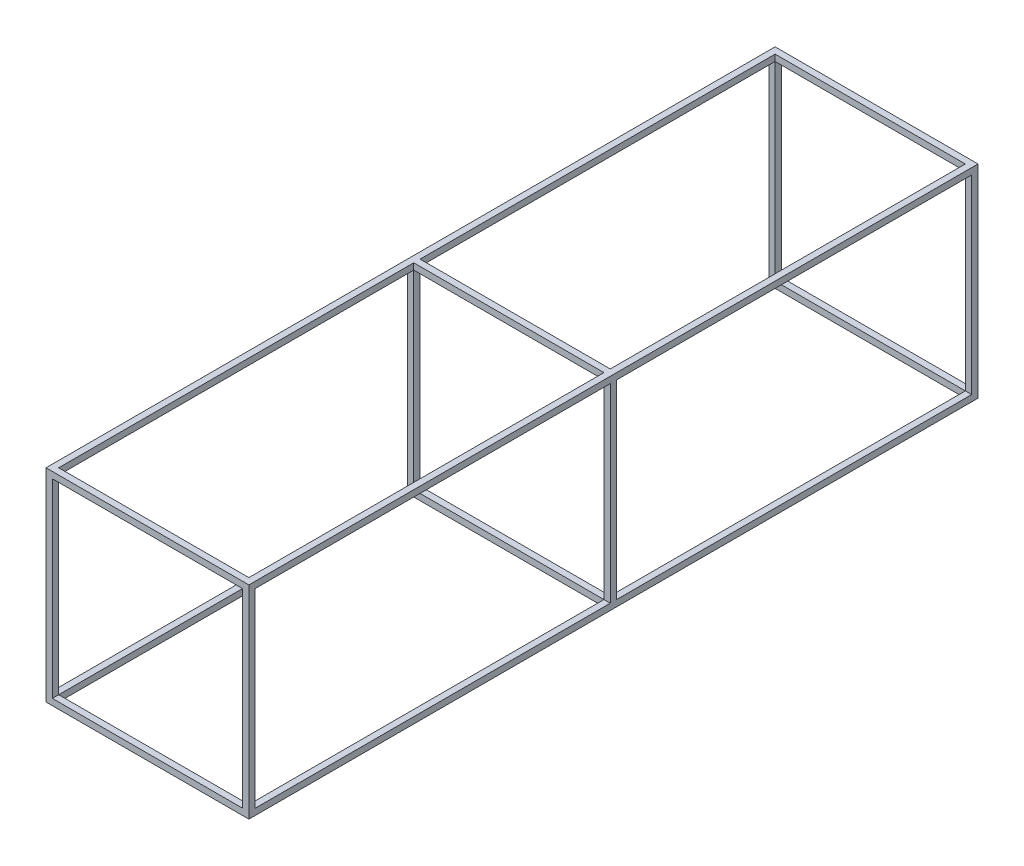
SolidWorks part; units mm, degrees
ref_plane "Front Plane" through (0, 0, 0) normal (0, 0, 1) x (1, 0, 0)
ref_plane "Top Plane" through (0, 0, 0) normal (0, 1, 0) x (1, 0, 0)
ref_plane "Right Plane" through (0, 0, 0) normal (1, 0, 0) x (0, 0, -1)
sketch "Sketch1" plane through (0, 0, 0) normal (0, 0, 1) x (1, 0, 0)
  line L0 (0, 0) -> (0, 160)
  line L1 (0, 160) -> (160, 160)
  line L2 (160, 160) -> (160, 0)
  line L3 (160, 0) -> (0, 0)
  line L4 (5, 155) -> (5, 5)
  line L5 (5, 5) -> (155, 5)
  line L6 (155, 5) -> (155, 155)
  line L7 (155, 155) -> (5, 155)
  dimension "D1" = 160
  dimension "D2" = 160
  dimension "D3" = 5
  dimension "D4" = 5
  dimension "D5" = 5
  dimension "D6" = 5
extrude "Boss-Extrude1" add sketch "Sketch1" along normal blind 5
sketch "Sketch2" plane through (0, 0, 5) normal (0, 0, 1) x (1, 0, 0)
  line L0 (5, 155) -> (5, 160)
  line L1 (160, 160) -> (0, 160) construction
  line L2 (5, 160) -> (0, 160)
  line L3 (0, 160) -> (0, 155)
  line L4 (0, 160) -> (0, 0) construction
  line L5 (0, 155) -> (5, 155)
  line L6 (5, 5) -> (5, 0)
  line L7 (5, 5) -> (155, 5) construction
  line L8 (5, 155) -> (5, 5) construction
  line L9 (0, 0) -> (160, 0) construction
  line L10 (5, 0) -> (0, 0)
  line L11 (0, 0) -> (0, 5)
  line L12 (0, 5) -> (5, 5)
  line L13 (155, 5) -> (160, 5)
  line L14 (160, 0) -> (160, 160) construction
  line L15 (160, 5) -> (160, 0)
  line L16 (160, 0) -> (155, 0)
  line L17 (155, 0) -> (155, 5)
  line L18 (155, 155) -> (160, 155)
  line L19 (160, 155) -> (160, 160)
  line L20 (160, 160) -> (155, 160)
  line L21 (155, 160) -> (155, 155)
extrude "Boss-Extrude2" add sketch "Sketch2" against normal blind 570
pattern_linear "LPattern1" count 3 spacing 285 along (0, 0, -1) of "Boss-Extrude1"
